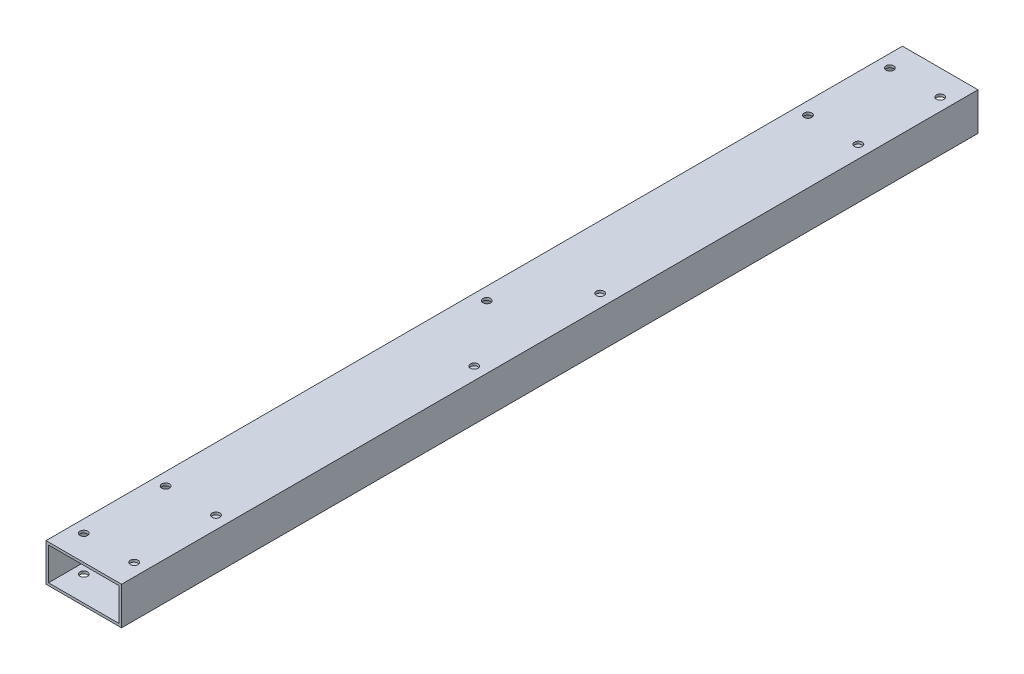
SolidWorks part; units mm, degrees
ref_plane "Front Plane" through (0, 0, 0) normal (0, 0, 1) x (1, 0, 0)
ref_plane "Top Plane" through (0, 0, 0) normal (0, 1, 0) x (1, 0, 0)
ref_plane "Right Plane" through (0, 0, 0) normal (1, 0, 0) x (0, 0, -1)
sketch "Sketch1" plane through (0, 0, 0) normal (0, 0, 1) x (1, 0, 0)
  line L1 (-30, 15) -> (30, 15)
  line L2 (-30, 15) -> (-30, -15)
  line L3 (-30, -15) -> (30, -15)
  line L4 (30, 15) -> (30, -15)
  line L5 (-30, 15) -> (30, -15) construction
  line L6 (-30, -15) -> (30, 15) construction
  line L7 (-28, 13) -> (28, 13)
  line L8 (-28, 13) -> (-28, -13)
  line L9 (-28, -13) -> (28, -13)
  line L10 (28, 13) -> (28, -13)
  line L11 (-28, 13) -> (28, -13) construction
  line L12 (-28, -13) -> (28, 13) construction
  point P4 (0, 0)
  point P12 (0, 0)
  dimension "D1" = 60
  dimension "D2" = 30
  dimension "D3" = 26
  dimension "D4" = 56
extrude "Boss-Extrude1" add sketch "Sketch1" along normal mid plane 680
sketch "Sketch2" plane through (0, 15, 0) normal (0, 1, 0) x (1, 0, 0)
  line L0 (-20, 320) -> (20, 320) construction
  line L1 (0, 340) -> (0, 320) construction
  line L2 (30, 340) -> (-30, 340) construction
  line L4 (-20, 285) -> (20, 285) construction
  line L5 (-20, 285) -> (-20, 255) construction
  line L6 (-20, 255) -> (20, 255) construction
  line L7 (20, 285) -> (20, 255) construction
  line L8 (-20, 285) -> (20, 255) construction
  line L9 (-20, 255) -> (20, 285) construction
  circle A0 centre (-20, 320) radius 3.05
  circle A1 centre (20, 320) radius 3.05
  circle A4 centre (-20, 255) radius 3.05
  circle A5 centre (20, 255) radius 3.05
  circle A6 centre (-20, 0) radius 3.05
  circle A7 centre (20, 50) radius 3.05
  point P12 (0, 270)
  dimension "D1" = 40
  dimension "D2" = 6.1
  dimension "D6" = 50
  dimension "D3" = 20
  dimension "D4" = 270
  dimension "D5" = 40
  dimension "D7" = 15
extrude "Cut-Extrude1" cut sketch "Sketch2" against normal through all both and the other way through all
sketch "Sketch3" plane through (0, -15, 0) normal (0, 1, 0) x (1, 0, 0)
  circle A0 centre (-20, 255) radius 3.05 construction
  circle A2 centre (20, 255) radius 3.05 construction
  circle A4 centre (-20, 255) radius 3.05 construction
  circle A6 centre (20, 255) radius 3.05 construction
  circle A10 centre (20, 255) radius 8
  circle A12 centre (-20, 255) radius 8
  circle A13 centre (-20, 0) radius 3.05 construction
  circle A14 centre (20, 50) radius 3.05 construction
  circle A15 centre (-20, 0) radius 3.05 construction
  circle A16 centre (20, 50) radius 3.05 construction
  circle A17 centre (20, 50) radius 8
  circle A18 centre (-20, 0) radius 8
  dimension "D1" = 16
extrude "Cut-Extrude2" cut sketch "Sketch3" against normal up to surface (28 mm away)
mirror "Mirror1" about plane through (0, 0, 0) normal (0, 0, 1) of "Cut-Extrude2", "Cut-Extrude1"
